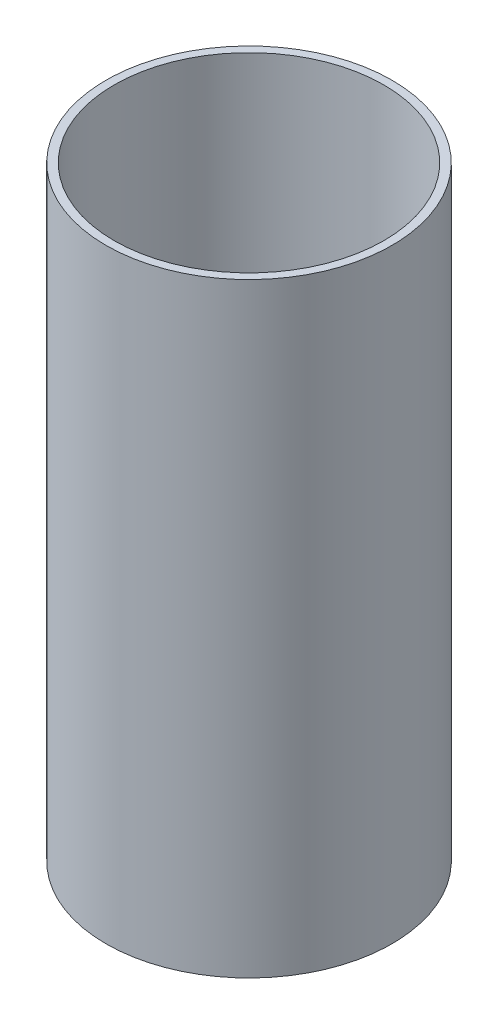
SolidWorks part; units mm, degrees
ref_plane "Front Plane" through (0, 0, 0) normal (0, 0, 1) x (1, 0, 0)
ref_plane "Top Plane" through (0, 0, 0) normal (0, 1, 0) x (1, 0, 0)
ref_plane "Right Plane" through (0, 0, 0) normal (1, 0, 0) x (0, 0, -1)
sketch "Sketch1" plane through (0, 0, 0) normal (0, 1, 0) x (1, 0, 0)
  circle A0 centre (0, 0) radius 27.1526
  dimension "D1" = 54.3052
extrude "Extrude-Thin1" add sketch "Sketch1" along normal blind 114.808 thin
